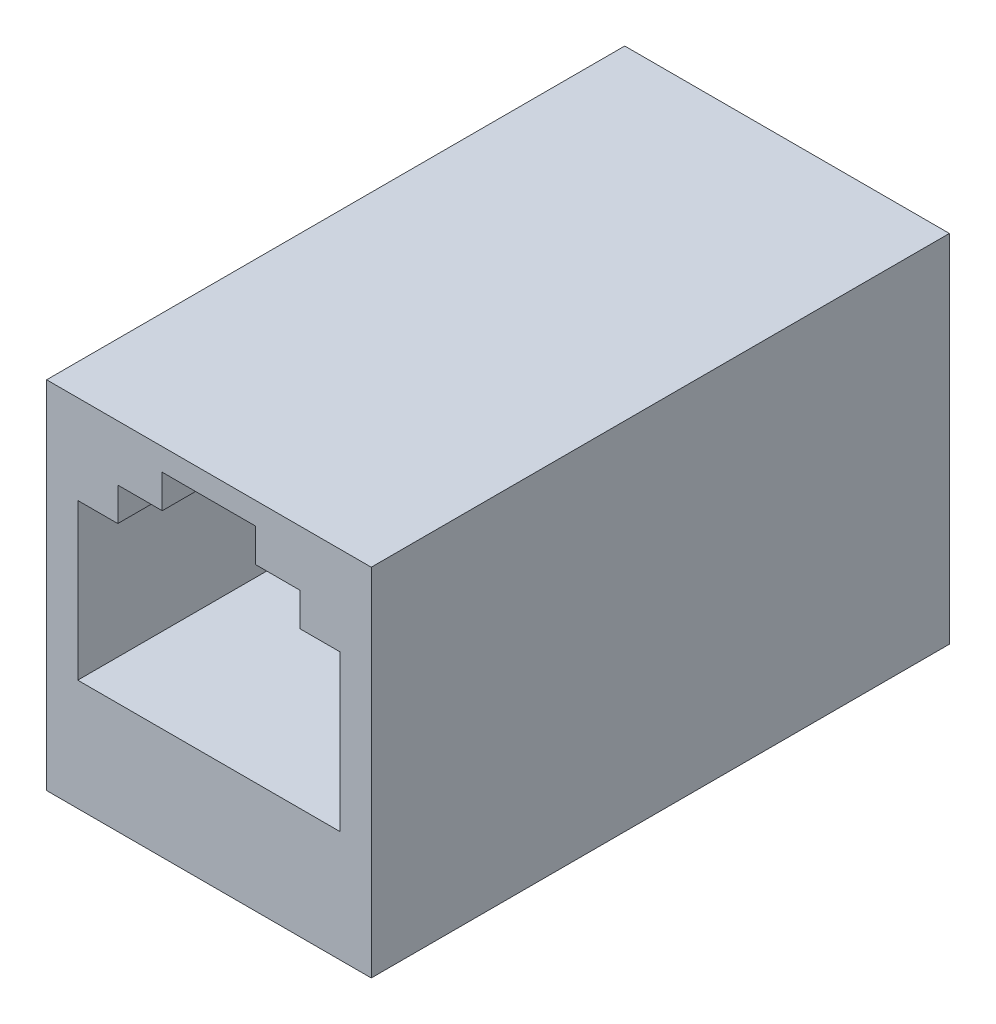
SolidWorks part; units mm, degrees
ref_plane "Front Plane" through (0, 0, 0) normal (0, 0, 1) x (1, 0, 0)
ref_plane "Top Plane" through (0, 0, 0) normal (0, 1, 0) x (1, 0, 0)
ref_plane "Right Plane" through (0, 0, 0) normal (1, 0, 0) x (0, 0, -1)
sketch "Sketch1" plane through (0, 0, 0) normal (0, 0, 1) x (1, 0, 0)
  line L1 (-7.5, 14.5) -> (7.5, 14.5)
  line L2 (-7.5, 14.5) -> (-7.5, 0)
  line L3 (-7.5, 0) -> (7.5, 0)
  line L4 (7.5, 14.5) -> (7.5, 0)
  dimension "D1" = 15
  dimension "D2" = 14.5
extrude "Boss-Extrude1" add sketch "Sketch1" against normal blind 13
sketch "Sketch3" plane through (0, 0, -13) normal (0, 0, -1) x (-1, 0, 0)
  line L0 (-7.5, 14.5) -> (7.5, 14.5) construction
  line L1 (-6.5, 13.5) -> (6.5, 13.5)
  line L2 (-6.5, 13.5) -> (-6.5, 11.5)
  line L3 (-6.5, 11.5) -> (6.5, 11.5)
  line L4 (6.5, 13.5) -> (6.5, 11.5)
  line L5 (-7.5, 0) -> (-7.5, 14.5) construction
  line L6 (7.5, 14.5) -> (7.5, 0) construction
  dimension "D1" = 2
  dimension "D2" = 1
  dimension "D3" = 1
  dimension "D4" = 1
extrude "Cut-Extrude1" cut sketch "Sketch3" against normal blind 10
ref_plane "Plane1" through (0, 13.5, 0) normal (0, -1, 0) x (1, 0, 0)
sketch "Sketch2" plane through (0, 13.5, 0) normal (0, 1, 0) x (1, 0, 0)
  line L0 (0, -0.9572) -> (0, 13.478) construction
  line L1 (-7.5, 13) -> (-7.5, 0) construction
  line L2 (-8.6, 3.3) -> (-7.5, 3.3)
  line L3 (-8.6, 3.3) -> (-8.6, 2.2)
  line L4 (-8.6, 2.2) -> (-7.5, 2.2)
  line L5 (-7.5, 3.3) -> (-7.5, 2.2)
  line L6 (7.5, 0) -> (-7.5, 0) construction
  line L7 (7.5, 3.3) -> (7.5, 2.2)
  line L8 (8.6, 2.2) -> (7.5, 2.2)
  line L9 (8.6, 3.3) -> (8.6, 2.2)
  line L10 (8.6, 3.3) -> (7.5, 3.3)
  dimension "D1" = 1.1
  dimension "D2" = 2.2
extrude "Boss-Extrude2" add sketch "Sketch2" against normal blind 10
sketch "Sketch4" plane through (0, 0, 0) normal (0, 0, 1) x (1, 0, 0)
  line L1 (-7.5, 0) -> (7.5, 0) construction
  line L2 (-5.9, 10.5) -> (5.9, 10.5)
  line L3 (-5.9, 10.5) -> (-5.9, 3.5)
  line L4 (-5.9, 3.5) -> (5.9, 3.5)
  line L7 (5.9, 10.5) -> (5.9, 3.5)
  line L8 (7.5, 3.5) -> (7.5, 13.5) construction
  line L9 (-7.5, 14.5) -> (-7.5, 0) construction
  dimension "D1" = 3.5
  dimension "D2" = 7
  dimension "D3" = 1.6
  dimension "D4" = 1.6
extrude "Cut-Extrude2" cut sketch "Sketch4" against normal blind 12
sketch "Sketch6" plane through (0, 0, 0) normal (0, 0, 1) x (1, 0, 0)
  line L0 (5.9, 10.5) -> (-5.9, 10.5) construction
  line L1 (-4.1, 10.5) -> (4.1, 10.5)
  line L2 (-4.1, 10.5) -> (-4.1, 12)
  line L3 (-4.1, 12) -> (4.1, 12)
  line L4 (4.1, 10.5) -> (4.1, 12)
  line L8 (-5.9, 10.5) -> (-5.9, 3.5) construction
  dimension "D1" = 1.5
  dimension "D2" = 8.2
  dimension "D3" = 1.8
extrude "Cut-Extrude4" cut sketch "Sketch6" against normal blind 12
sketch "Sketch8" plane through (0, 0, 0) normal (0, 0, 1) x (1, 0, 0)
  line L0 (4.1, 12) -> (-4.1, 12) construction
  line L1 (-2.1, 12) -> (2.1, 12)
  line L2 (-2.1, 12) -> (-2.1, 13.5)
  line L3 (-2.1, 13.5) -> (2.1, 13.5)
  line L4 (2.1, 12) -> (2.1, 13.5)
  line L6 (-4.1, 12) -> (-4.1, 10.5) construction
  line L7 (7.5, 14.5) -> (-7.5, 14.5) construction
  dimension "D1" = 1
  dimension "D2" = 4.2
  dimension "D3" = 2
extrude "Cut-Extrude5" cut sketch "Sketch8" against normal up to surface (13 mm away)
sketch "Sketch9" plane through (4.1, 0, 0) normal (-1, 0, 0) x (0, 0, 1)
  line L0 (-3, 11.5) -> (-13, 10.5)
  line L1 (-13, 14.5) -> (-13, 0) construction
  line L2 (-13, 10.5) -> (-13, 11.5)
  line L3 (-13, 11.5) -> (-3, 11.5)
  dimension "D1" = 1
extrude "Cut-Extrude6" cut sketch "Sketch9" against normal up to surface and the other way up to surface
sketch "Sketch10" plane through (0, 0, -12) normal (0, 0, 1) x (1, 0, 0)
  line L0 (-4.1, 10.6) -> (-4.1, 10.5) construction
  line L1 (-5.9, 10.5) -> (-4.1, 10.5)
  line L2 (-5.9, 10.5) -> (-5.9, 9.5)
  line L3 (-5.9, 9.5) -> (-4.1, 9.5)
  line L4 (-4.1, 10.5) -> (-4.1, 9.5)
  dimension "D1" = 1
extrude "Boss-Extrude3" add sketch "Sketch10" along normal blind 2
mirror "Mirror1" about plane through (0, 0, 0) normal (1, 0, 0) of "Boss-Extrude3"
ref_plane "Plane2" through (7.5, 0, 0) normal (1, 0, 0) x (0, 0, -1)
sketch "Sketch26" plane through (0, 3.5, 0) normal (0, -1, 0) x (1, 0, 0)
  line L1 (8.6, -3.3) -> (7.5, -3.3)
  line L2 (8.6, -3.3) -> (8.6, -2.2)
  line L3 (8.6, -2.2) -> (7.5, -2.2)
  line L4 (7.5, -3.3) -> (7.5, -2.2)
extrude "Cut-Extrude9" cut sketch "Sketch26" against normal through all
mirror "Mirror2" about plane through (0, 0, 0) normal (1, 0, 0) of "Cut-Extrude9"
sketch "Sketch28" plane through (0, 0, 0) normal (0, 0, 1) x (1, 0, 0)
  line L0 (-7.5, 14.5) -> (-7.5, 0) construction
  line L1 (7.5, 0) -> (-7.5, 0)
  line L2 (7.5, 0) -> (7.5, -1.5)
  line L3 (7.5, -1.5) -> (-7.5, -1.5)
  line L4 (-7.5, 0) -> (-7.5, -1.5)
  dimension "D1" = 1.5
extrude "Boss-Extrude4" add sketch "Sketch28" along direction (0, 0, 1) on the side against the normal blind 13
sketch "Sketch29" plane through (0, 0, -13) normal (0, 0, -1) x (-1, 0, 0)
  line L1 (-7.5, 14.5) -> (7.5, 14.5)
  line L2 (-7.5, 14.5) -> (-7.5, -1.5)
  line L3 (-7.5, -1.5) -> (7.5, -1.5)
  line L4 (7.5, 14.5) -> (7.5, -1.5)
extrude "Boss-Extrude5" add sketch "Sketch29" along normal blind 13
sketch "Sketch31" plane through (0, 0, 0) normal (0, 0, 1) x (1, 0, 0)
  line L0 (-7.5, -1.5) -> (7.5, -1.5) construction
  line L1 (-7.5, 14.5) -> (-7.3, 14.5)
  line L2 (-7.5, 14.5) -> (-7.5, -1.5)
  line L3 (-7.5, -1.5) -> (-7.3, -1.5)
  line L4 (-7.3, 14.5) -> (-7.3, -1.5)
  dimension "D1" = 0.2
extrude "Cut-Extrude10" cut sketch "Sketch31" against normal through all
mirror "Mirror3" about plane through (0, 0, 0) normal (1, 0, 0) of "Cut-Extrude10"
